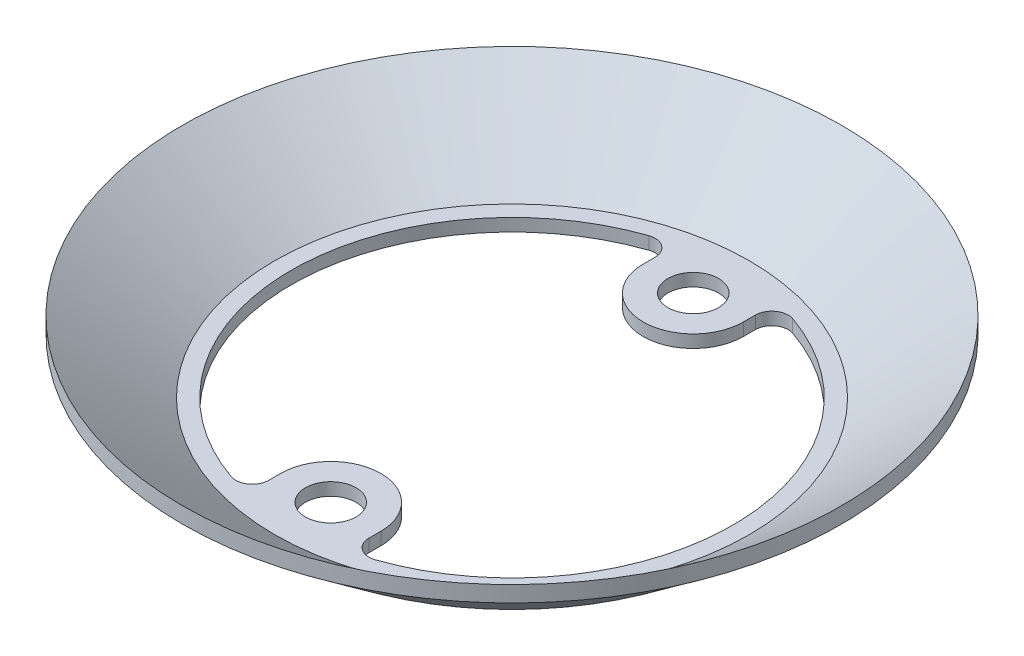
SolidWorks part; units mm, degrees
ref_plane "Front Plane" through (0, 0, 0) normal (0, 0, 1) x (1, 0, 0)
ref_plane "Top Plane" through (0, 0, 0) normal (0, 1, 0) x (1, 0, 0)
ref_plane "Right Plane" through (0, 0, 0) normal (1, 0, 0) x (0, 0, -1)
sketch "Sketch1" plane through (0, 0, 0) normal (1, 0, 0) x (0, 0, -1)
  line L0 (0, 0) -> (0, 47.3738) construction
  line L1 (0, 0) -> (116.3859, 0) construction
  line L2 (31.75, 8.0772) -> (31.75, 6.5374)
  line L3 (31.75, 6.5374) -> (23.2756, 0)
  line L4 (23.2756, 0) -> (21.2725, 0)
  line L5 (30.5308, 7.1367) -> (22.86, 1.2192) construction
  line L6 (31.75, 8.0772) -> (22.86, 1.2192)
  line L7 (22.86, 1.2192) -> (21.2725, 1.2192)
  line L8 (30.5308, 17.6691) -> (30.5308, 7.1367) construction
  line L9 (21.2725, 1.2192) -> (21.2725, 0)
  line L10 (31.75, 17.6691) -> (31.75, 6.5374) construction
  dimension "D2" = 63.5
  dimension "D3" = 42.545
  dimension "D4" = 45.72
  dimension "D5" = 8.0772
  dimension "D1" = 1.2192
revolve "Revolve1" add sketch "Sketch1" angle 360 about L0
sketch "Sketch2" plane through (0, 1.2192, 0) normal (0, 1, 0) x (1, 0, 0)
  line L0 (0, 0) -> (0, 33.6412) construction
  line L1 (0, 0) -> (6.4777, 0) construction
  line L2 (-4.826, 17.4625) -> (-4.826, 21.9733)
  line L3 (4.826, 17.4625) -> (4.826, 21.9733)
  line L4 (-4.826, 21.9733) -> (4.826, 21.9733)
  circle A0 centre (0, 17.4625) radius 2.4384
  arc A1 (-4.826, 17.4625) -> (4.826, 17.4625) centre (0, 17.4625) ccw
  dimension "D1" = 34.925
  dimension "D2" = 4.8768
  dimension "D3" = 9.652
extrude "Boss-Extrude1" add sketch "Sketch2" against normal blind 1.2192
mirror "Mirror1" about plane through (0, 0, 0) normal (0, 0, 1) of "Boss-Extrude1"
fillet "Fillet1" radius 1.5875 4 edges at (4.826, 0.6096, 20.7178) (-4.826, 0.6096, 20.7178) (-4.826, 0.6096, -20.7178) (4.826, 0.6096, -20.7178)
